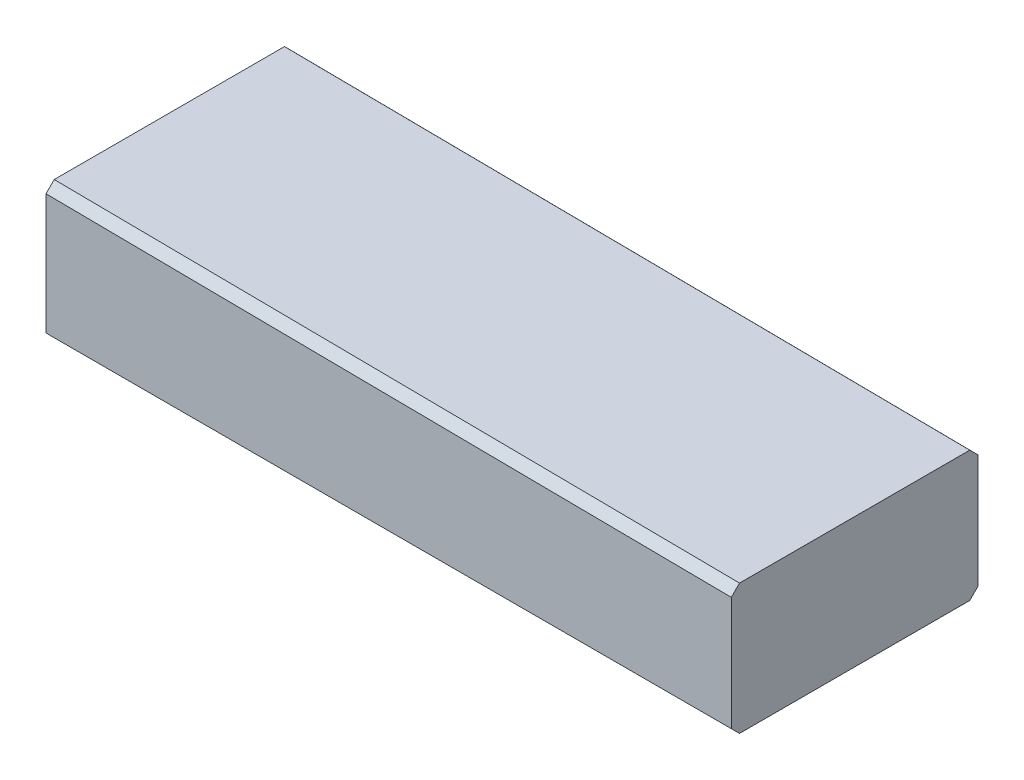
SolidWorks part; units mm, degrees
ref_plane "Front Plane" through (0, 0, 0) normal (0, 0, 1) x (1, 0, 0)
ref_plane "Top Plane" through (0, 0, 0) normal (0, 1, 0) x (1, 0, 0)
ref_plane "Right Plane" through (0, 0, 0) normal (1, 0, 0) x (0, 0, -1)
sketch "BodySke" plane through (0, 0, 0) normal (0, 0, 1) x (1, 0, 0)
  line L0 (0, 0) -> (2000, 0) construction
  line L1 (0, 0) -> (0, 20)
  line L2 (0, 20) -> (2000, 0) construction
  line L3 (100, 19) -> (100, 0)
  line L4 (100, 0) -> (0, 0)
  line L5 (0, 20) -> (100, 19)
  dimension "Height" = 20
  dimension "D2" = 2000
  dimension "Length" = 100
extrude "BaseBody" add sketch "BodySke" along normal blind 36
chamfer "Chamfer1" distance 1.2 angle 45 4 edges at (50, 19.5, 0) (50, 0, 0) (50, 0, 36) (50, 19.5, 36)
equation "\"D2@BodySke\" = \"Height@BodySke\" * 100"
